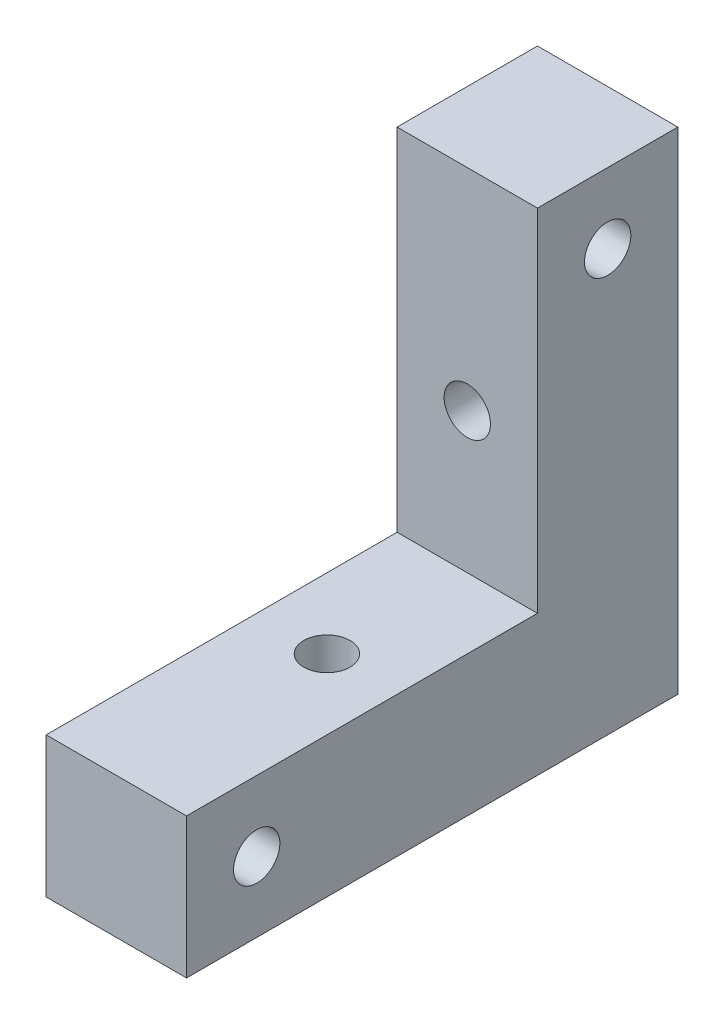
SolidWorks part; units mm, degrees
ref_plane "前视基准面" through (0, 0, 0) normal (0, 0, 1) x (1, 0, 0)
ref_plane "上视基准面" through (0, 0, 0) normal (0, 1, 0) x (1, 0, 0)
ref_plane "右视基准面" through (0, 0, 0) normal (1, 0, 0) x (0, 0, -1)
other "Configuration Table"
sketch "草图1" plane through (0, 0, 0) normal (0, 0, 1) x (1, 0, 0)
  line L1 (-5, 5) -> (5, 5)
  line L2 (-5, 5) -> (-5, -5)
  line L3 (-5, -5) -> (5, -5)
  line L4 (5, 5) -> (5, -5)
  line L5 (-5, 5) -> (5, -5) construction
  line L6 (-5, -5) -> (5, 5) construction
  point P0 (0, 0)
  dimension "D1" = 10
  dimension "D2" = 10
extrude "凸台-拉伸1" add sketch "草图1" along normal blind 35
sketch "草图2" plane through (0, 5, 0) normal (0, 1, 0) x (1, 0, 0)
  line L0 (5, -35) -> (5, 0) construction
  line L1 (-5, 0) -> (5, 0)
  line L2 (-5, 0) -> (-5, -10)
  line L3 (-5, -10) -> (5, -10)
  line L4 (5, 0) -> (5, -10)
  dimension "D1" = 10
extrude "凸台-拉伸2" add sketch "草图2" along normal blind 25
sketch "草图9" plane through (0, 0, 35) normal (0, 0, 1) x (1, 0, 0)
  line L4 (5, -5) -> (5, 5)
  line L5 (5, 5) -> (-5, 5)
  line L6 (-5, 5) -> (-5, -5)
  line L7 (-5, -5) -> (5, -5)
  line L8 (5, -5) -> (5, 5)
  line L9 (5, 5) -> (-5, 5)
  line L10 (-5, 5) -> (-5, -5)
  line L11 (-5, -5) -> (5, -5)
  dimension "D1" = 0
hole_wizard "M4 螺纹孔4" positions "草图11" profile "草图12" tap size "M4" standard "GB"
sketch "草图11" plane through (0, 0, 0) normal (0, 0, -1) x (-1, 0, 0)
  line L0 (5, -5) -> (-5, -5) construction
  point P0 (0, 15)
  dimension "D1" = 20
sketch "草图12" plane through (0, 15, 0) normal (1, 0, 0) x (0, 1, 0)
  line L0 (0, 0) -> (0, 35)
  line L1 (0, 35) -> (1.65, 35)
  line L2 (1.65, 35) -> (1.65, 0)
  line L5 (1.65, 0) -> (0, 0)
  line L11 (0, -6.35) -> (0, 107.95) construction
  dimension "通孔螺纹孔钻头直径" = 3.3
  dimension "通孔螺纹孔钻头深度" = 35
hole_wizard "M4 螺纹孔5" positions "草图13" profile "草图14" tap size "M4" standard "GB"
sketch "草图13" plane through (0, -5, 0) normal (0, -1, 0) x (-1, 0, 0)
  line L0 (5, 0) -> (-5, 0) construction
  point P0 (0, -20)
  dimension "D1" = 20
sketch "草图14" plane through (0, -5, 20) normal (1, 0, 0) x (0, 0, -1)
  line L0 (0, 0) -> (0, 35)
  line L1 (0, 35) -> (1.65, 35)
  line L2 (1.65, 35) -> (1.65, 0)
  line L5 (1.65, 0) -> (0, 0)
  line L11 (0, -6.35) -> (0, 107.95) construction
  dimension "通孔螺纹孔钻头直径" = 3.3
  dimension "通孔螺纹孔钻头深度" = 35
hole_wizard "M4 螺纹孔7" positions "草图17" profile "草图18" tap size "M4" standard "GB"
sketch "草图17" plane through (-5, 0, 0) normal (-1, 0, 0) x (0, 0, 1)
  line L0 (0, 30) -> (0, -5) construction
  line L1 (0, 30) -> (10, 30) construction
  line L2 (35, 5) -> (10, 5) construction
  line L3 (35, -5) -> (35, 5) construction
  point P0 (5, 25)
  point P2 (30, 0)
  dimension "D1" = 5
  dimension "D2" = 5
  dimension "D3" = 5
  dimension "D4" = 5
sketch "草图18" plane through (-5, 25, 5) normal (0, 1, 0) x (0, 0, 1)
  line L0 (0, 0) -> (0, 10)
  line L1 (0, 10) -> (1.65, 10)
  line L2 (1.65, 10) -> (1.65, 0)
  line L5 (1.65, 0) -> (0, 0)
  line L11 (0, -6.35) -> (0, 107.95) construction
  dimension "通孔螺纹孔钻头直径" = 3.3
  dimension "通孔螺纹孔钻头深度" = 10
